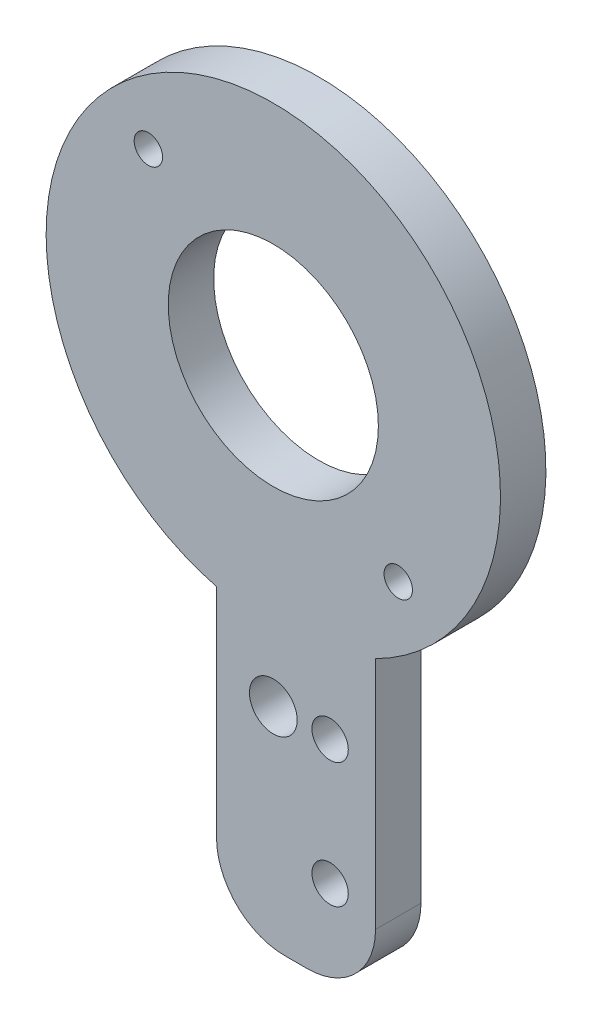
SolidWorks part; units mm, degrees
ref_plane "Front" through (0, 0, 0) normal (0, 0, 1) x (1, 0, 0)
ref_plane "Top" through (0, 0, 0) normal (0, 1, 0) x (1, 0, 0)
ref_plane "Right" through (0, 0, 0) normal (1, 0, 0) x (0, 0, -1)
sketch "Esquisse1" plane through (0, 0, 0) normal (0, 0, 1) x (1, 0, 0)
  line L0 (0, 20) -> (0, -44.5) construction
  line L1 (0, -26) -> (5, -26) construction
  line L3 (-5, -19.3649) -> (-5, -38.5)
  line L4 (1, -44.5) -> (3, -44.5)
  line L5 (9, -17.8606) -> (9, -38.5)
  line L6 (5, -26) -> (5, -37) construction
  line L7 (5, -37) -> (0, -37) construction
  line L8 (20, 0) -> (-20, 0) construction
  line L9 (-11, 11) -> (11, 11) construction
  line L10 (-11, 11) -> (-11, -11) construction
  line L11 (-11, -11) -> (11, -11) construction
  line L12 (11, 11) -> (11, -11) construction
  arc A0 (9, -17.8606) -> (-5, -19.3649) centre (0, 0) ccw
  arc A1 (3, -44.5) -> (9, -38.5) centre (3, -38.5) ccw
  arc A2 (1, -44.5) -> (-5, -38.5) centre (1, -38.5) cw
  circle A5 centre (0, 0) radius 9.25
  point P13 (9, -44.5)
  point P16 (-5, -44.5)
  point P22 (0, 11)
  point P26 (2.6313, 0)
  point P27 (2.6313, 0)
  point P28 (11, 0)
  dimension "D1" = 26
  dimension "D2" = 40
  dimension "D7" = 6
  dimension "D8" = 18.5
  dimension "D9" = 22
  dimension "D3" = 11
  dimension "D4" = 5
  dimension "D5" = 5
  dimension "D6" = 14
  dimension "D10" = 22
extrude "Boss.-Extru.1" add sketch "Esquisse1" along normal blind 4
hole_wizard "Diamètre du perçage Ø3.2 (3.2)1" positions "Esquisse2" profile "Esquisse3" hole size "Ø3.2" standard "ISO"
sketch "Esquisse2" plane through (0, 0, 4) normal (0, 0, 1) x (1, 0, 0)
  point P0 (5, -26)
  point P3 (5, -37)
sketch "Esquisse3" plane through (5, -26, 4) normal (1, 0, 0) x (0, -1, 0)
  line L0 (0, 0) -> (0, 4)
  line L1 (0, 4) -> (1.6, 4)
  line L2 (1.6, 4) -> (1.6, 0)
  line L5 (1.6, 0) -> (0, 0)
  line L11 (0, -6.35) -> (0, 107.95) construction
  dimension "Diamètre du perçage jusqu'au prochain" = 3.2
  dimension "Profondeur du perçage jusqu'au prochain" = 4
hole_wizard "Diamètre du perçage Ø4.2 (4.2)1" positions "Esquisse4" profile "Esquisse5" hole size "Ø4.2" standard "ISO"
sketch "Esquisse4" plane through (0, 0, 4) normal (0, 0, 1) x (1, 0, 0)
  point P0 (0, -26)
sketch "Esquisse5" plane through (0, -26, 4) normal (1, 0, 0) x (0, -1, 0)
  line L0 (0, 0) -> (0, 4)
  line L1 (0, 4) -> (2.1, 4)
  line L2 (2.1, 4) -> (2.1, 0)
  line L5 (2.1, 0) -> (0, 0)
  line L11 (0, -6.35) -> (0, 107.95) construction
  dimension "Diamètre du perçage jusqu'au prochain" = 4.2
  dimension "Profondeur du perçage jusqu'au prochain" = 4
hole_wizard "Trou taraudé M31" positions "Esquisse10" profile "Esquisse11" tap size "M3" standard "ISO"
sketch "Esquisse10" plane through (0, 0, 4) normal (0, 0, 1) x (1, 0, 0)
  point P6 (-11, 11)
  point P9 (11, -11)
sketch "Esquisse11" plane through (-11, 11, 4) normal (1, 0, 0) x (0, -1, 0)
  line L0 (0, 0) -> (0, 4)
  line L1 (0, 4) -> (1.25, 4)
  line L2 (1.25, 4) -> (1.25, 0)
  line L5 (1.25, 0) -> (0, 0)
  line L11 (0, -6.35) -> (0, 107.95) construction
  dimension "Diamètre du trou pour taraudage jusqu'au prochain" = 2.5
  dimension "Profondeur du trou pour taraudage jusqu'au prochain" = 4
sketch "Esquisse12" plane through (0, 0, 4) normal (0, 0, 1) x (1, 0, 0)
  line L0 (0, 0) -> (93.9693, -34.202) construction
  line L1 (1.7101, 4.6985) -> (95.6794, -29.5036)
  line L2 (-1.7101, -4.6985) -> (92.2592, -38.9005)
  line L3 (9, -38.5) -> (9, -17.8606) construction
  arc A0 (1.7101, 4.6985) -> (-1.7101, -4.6985) centre (0, 0) ccw
  arc A1 (92.2592, -38.9005) -> (95.6794, -29.5036) centre (93.9693, -34.202) ccw
  point P3 (46.9846, -17.101)
  dimension "D1" = 5
  dimension "D2" = 100
  dimension "D3" = 70
extrude "Boss.-Extru.2" [suppressed] add sketch "Esquisse12" along normal blind 10
sketch "Esquisse13" [suppressed] plane through (0, 0, 4) normal (0, 0, 1) x (1, 0, 0)
  line L0 (0, 0) -> (-17.3648, 98.4808) construction
  line L1 (-4.924, -0.8682) -> (-22.2889, 97.6125)
  line L2 (4.924, 0.8682) -> (-12.4408, 99.349)
  line L3 (9, -38.5) -> (9, -17.8606) construction
  arc A0 (-4.924, -0.8682) -> (4.924, 0.8682) centre (0, 0) ccw
  arc A1 (-12.4408, 99.349) -> (-22.2889, 97.6125) centre (-17.3648, 98.4808) ccw
  point P3 (-8.6824, 49.2404)
  dimension "D1" = 5
  dimension "D2" = 100
  dimension "D3" = 190
extrude "Boss.-Extru.3" [suppressed] add sketch "Esquisse13" along normal blind 10
